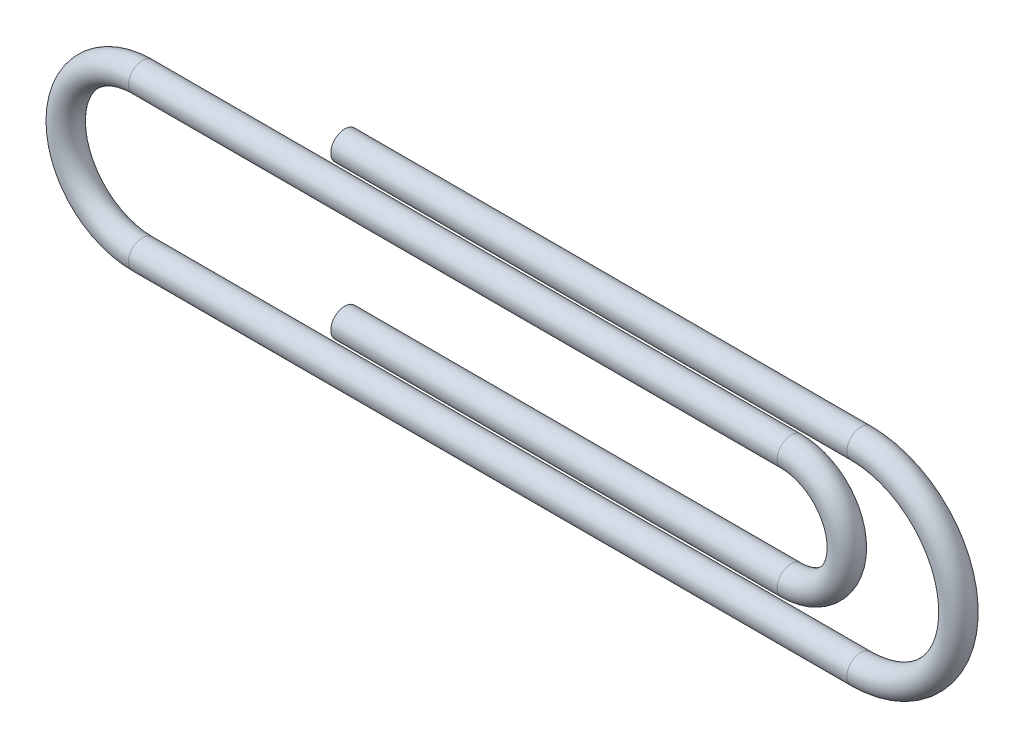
SolidWorks part; units mm, degrees
ref_plane "Front Plane" through (0, 0, 0) normal (0, 0, 1) x (1, 0, 0)
ref_plane "Top Plane" through (0, 0, 0) normal (0, 1, 0) x (1, 0, 0)
ref_plane "Right Plane" through (0, 0, 0) normal (1, 0, 0) x (0, 0, -1)
sketch "Sketch1" plane through (0, 0, 0) normal (0, 0, 1) x (1, 0, 0)
  line L0 (0, 0) -> (16, 0)
  line L1 (16, 4) -> (-7.25, 4)
  line L2 (-7.25, -1.5) -> (18.5, -1.5)
  line L3 (18.5, 5.5) -> (0, 5.5)
  arc A0 (16, 0) -> (16, 4) centre (16, 2) ccw
  arc A1 (-7.25, 4) -> (-7.25, -1.5) centre (-7.25, 1.25) ccw
  arc A2 (18.5, -1.5) -> (18.5, 5.5) centre (18.5, 2) ccw
  dimension "D1" = 3.5
  dimension "D4" = 4
  dimension "D6" = 32
  dimension "D2" = 10
  dimension "D3" = 1.5
  dimension "D5" = 1.5
sketch "Sketch2" plane through (0, 0, 0) normal (1, 0, 0) x (0, 0, -1)
  circle A0 centre (0, 0) radius 0.5
  dimension "D1" = 1
sweep "Sweep1" add profiles "Sketch2" path "Sketch1"
